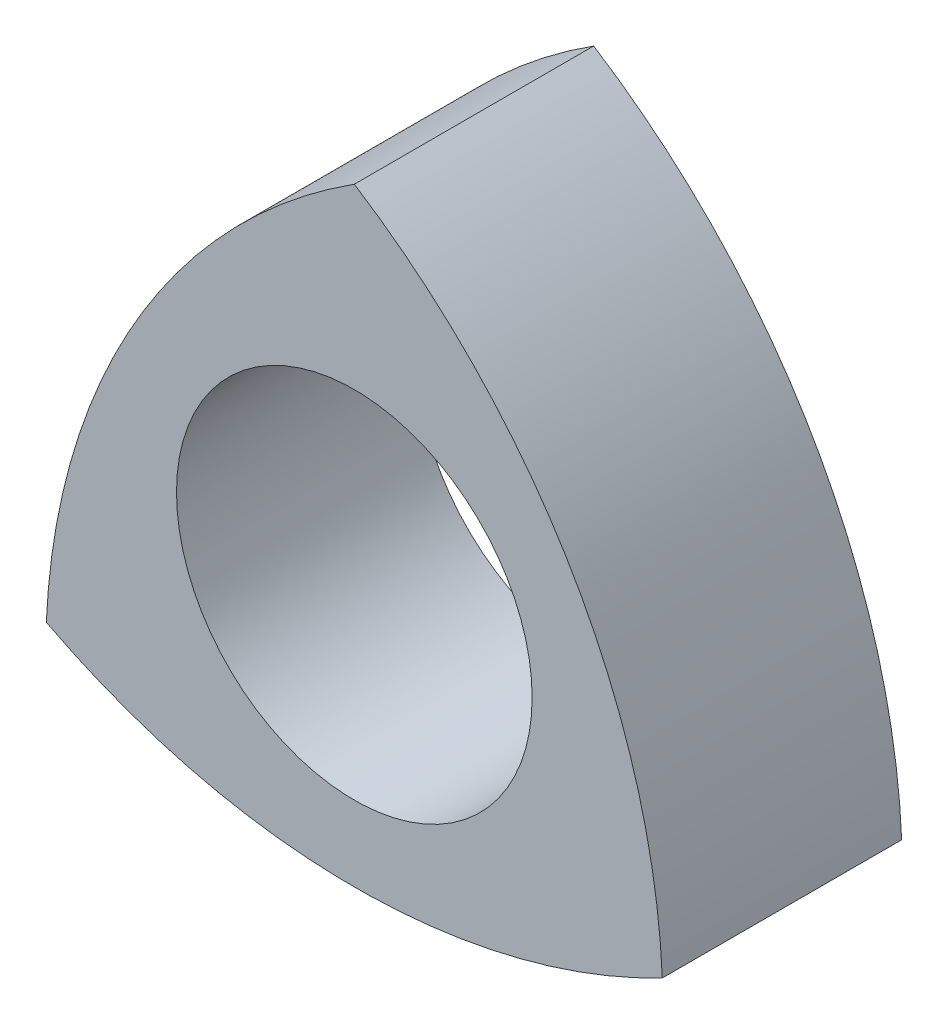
SolidWorks part; units mm, degrees
ref_plane "Front Plane" through (0, 0, 0) normal (0, 0, 1) x (1, 0, 0)
ref_plane "Top Plane" through (0, 0, 0) normal (0, 1, 0) x (1, 0, 0)
ref_plane "Right Plane" through (0, 0, 0) normal (1, 0, 0) x (0, 0, -1)
sketch "Sketch1" plane through (0, 0, 0) normal (0, 0, 1) x (1, 0, 0)
  line L0 (0, 0) -> (0, 264.16) construction
  line L1 (0, 0) -> (228.7693, -132.08) construction
  arc A1 (0, 264.16) -> (228.7693, -132.08) centre (-266.9641, -154.1318) cw
  arc A2 (0, 264.16) -> (-228.7693, -132.08) centre (266.9641, -154.1318) ccw
  arc A3 (-228.7693, -132.08) -> (228.7693, -132.08) centre (0, 308.2636) ccw
  circle A4 centre (0, 0) radius 132.08
extrude "Boss-Extrude1" add sketch "Sketch1" along normal blind 177.8
equation "\"E\"= 1.500000"
equation "\"R\"= 10.400000"
equation "\"RRS\"= 19.536364"
equation "\"HHS\"= 11.900000"
equation "\"W\"= 7.000000"
equation "\"D1@Boss-Extrude1\"=\"W\""
equation "\"D1@Sketch1\"=\"R\""
equation "\"D2@Sketch1\"=\"R\""
equation "\"D3@Sketch1\"=\"RRS\""
